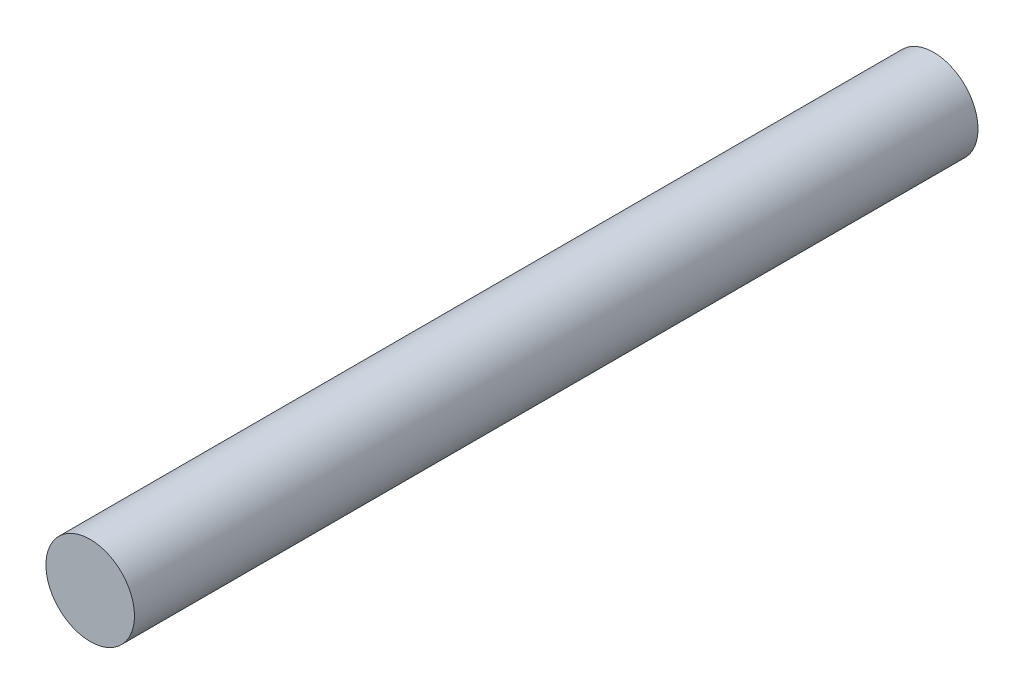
SolidWorks part; units mm, degrees
ref_plane "Front Plane" through (0, 0, 0) normal (0, 0, 1) x (1, 0, 0)
ref_plane "Top Plane" through (0, 0, 0) normal (0, 1, 0) x (1, 0, 0)
ref_plane "Right Plane" through (0, 0, 0) normal (1, 0, 0) x (0, 0, -1)
sketch "Sketch1" plane through (0, 0, 0) normal (0, 0, 1) x (1, 0, 0)
  circle A0 centre (0, 0) radius 52.5
  dimension "D1" = 105
extrude "Boss-Extrude1" add sketch "Sketch1" along normal blind 1000
